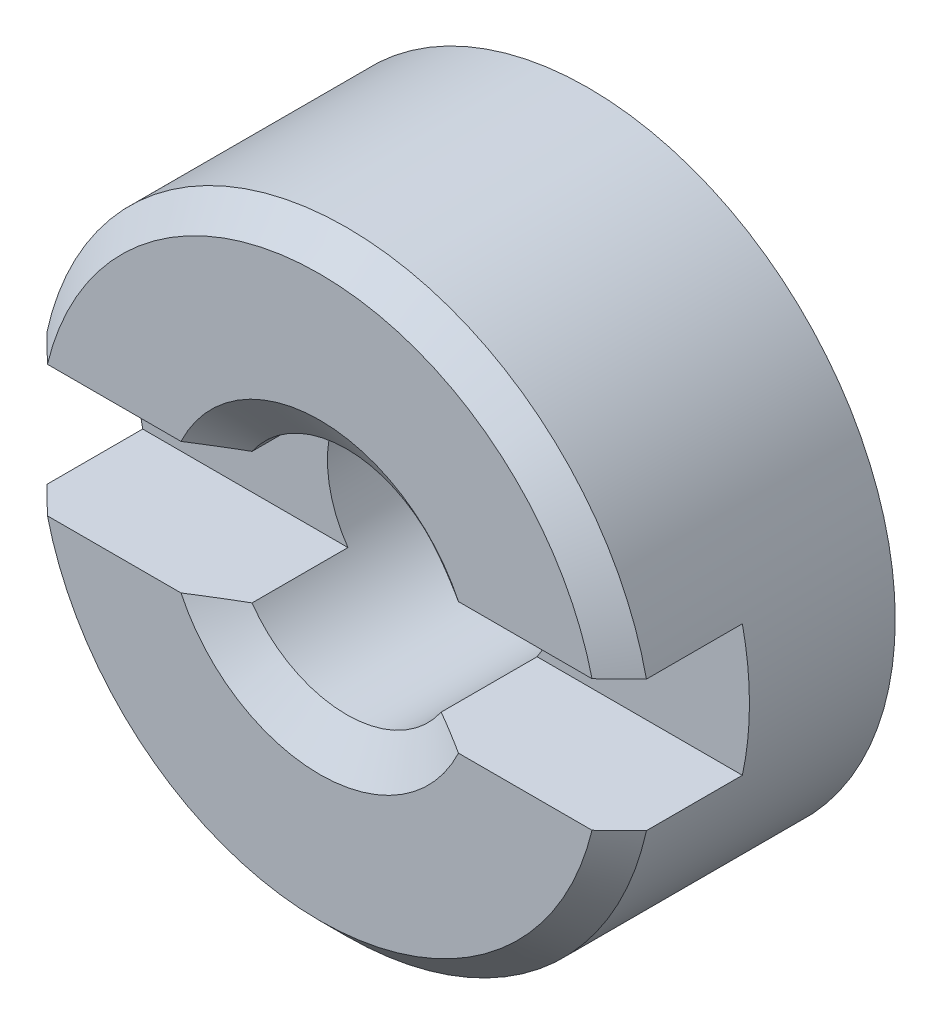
SolidWorks part; units mm, degrees
extrude "BaseNut" add sketch "BaseNutSke" against normal blind 3.5
sketch "BaseNutSke" plane through (0, 0, 0) normal (0, 0, 1) x (1, 0, 0)
  circle A0 centre (0, 0) radius 1.5
  circle A1 centre (0, 0) radius 4
  dimension "Tap_drill" = 3
  dimension "Outerdia" = 8
pattern_linear "ThdSchPat" [suppressed]
revolve "ThreadSchematic" cut sketch "ThdSchSke" angle 360 about L6
sketch "ThdSchSke" plane through (0, 0, 0) normal (0, 1, 0) x (1, 0, 0)
  line L0 (-2, 0.025) -> (-1.5, 0.3751)
  line L1 (-1.5, 0.3751) -> (-0.75, 0.3751)
  line L2 (-0.75, 0.3751) -> (-0.75, -0.3251)
  line L3 (-0.75, -0.3251) -> (-1.5, -0.3251)
  line L4 (-1.5, -0.3251) -> (-2, 0.025)
  line L5 (-3.175, 0.525) -> (3.175, 0.525) construction
  line L6 (0, 0.525) -> (0, 6.35) construction
  line L7 (0, 1.6) -> (0, 0.3501) construction
chamfer "Chamfer1" distance 6.35 angle 45 1 edges at (4, 0, 0)
ref_plane "Plane1" through (0, 0, 0) normal (0, 0, 1) x (1, 0, 0)
ref_plane "Plane2" through (0, 0, 0) normal (0, 1, 0) x (1, 0, 0)
ref_plane "Plane3" through (0, 0, 0) normal (1, 0, 0) x (0, 0, -1)
other "Configuration Table"
sketch "EndChSke" plane through (0, 0, 0) normal (1, 0, 0) x (0, 0, -1)
  line L0 (3.4746, 2) -> (3.0895, 1.45)
  line L1 (3.5254, 2) -> (3.4746, 2)
  line L2 (3.5254, 2) -> (3.5254, 1.45)
  line L3 (3.5254, 1.45) -> (3.0895, 1.45)
  line L6 (-0.0508, 2) -> (0, 2)
  line L7 (0, 2) -> (0.3851, 1.45)
  line L9 (0.3851, 1.45) -> (-0.0508, 1.45)
  line L10 (-0.0508, 1.45) -> (-0.0508, 2)
  line L11 (25.0375, 0) -> (38.388, 0) construction
  line L12 (3.5, 0) -> (0, 0) construction
revolve "EndChamfer" cut sketch "EndChSke" angle 360 about L11
sketch "SlotSke" plane through (0, 0, 0) normal (1, 0, 0) x (0, 0, -1)
  line L0 (0, 0.855) -> (1.6, 0.855)
  line L1 (1.6, 0.855) -> (1.6, -0.855)
  line L3 (1.6, -0.855) -> (0, -0.855)
  line L4 (0, 3.65) -> (0, -3.65) construction
  line L5 (0, 0.855) -> (0, -0.855)
extrude "Cut-Extrude1" cut sketch "SlotSke" against normal through all and the other way through all
equation "\"Tap_Drill@ThdSchSke\" = \"Tap_drill@BaseNutSke\""
equation "\"OverCut@ThdSchSke\" = \"Tap_Drill@ThdSchSke\" * 0.5"
equation "\"Num_threads@ThdSchPat\" = int(  ( \"Thickness@BaseNut\" - 0.0508 ) / \"Advance@ThdSchSke\" + 0.999 )  + 1"
equation "\"Advance@ThdSchPat\" = ( \"Thickness@BaseNut\" - 0.0508 ) /  (\"Num_threads@ThdSchPat\" - 1) 'relax it"
equation "' \"Num_threads@ThdSchPat\" = \"Num_threads@ThdSchPat\" - sgn( \"Num_threads@ThdSchPat\" - 1) '---chamfered tips only---"
equation "\"ThreadMajor@EndChSke\" = \"Thread_major@ThdSchSke\" * 0.5"
equation "\"ChamferDepth@EndChSke\" = (\"Thread_major@ThdSchSke\" - \"Tap_drill@BaseNutSke\") * 0.55"
equation "\"Offset1@EndChSke\" = \"Thickness@BaseNut\" + 0.0254"
equation "\"Offset2@EndChSke\" = \"Offset1@EndChSke\" + 0.0508"
equation "\"Chamfer_len@Chamfer1\" = 0.1 * \"Thickness@BaseNut\""
equation "\"HalfSlot_thick@SlotSke\" = \"Slot_thick@SlotSke\" / 2"
